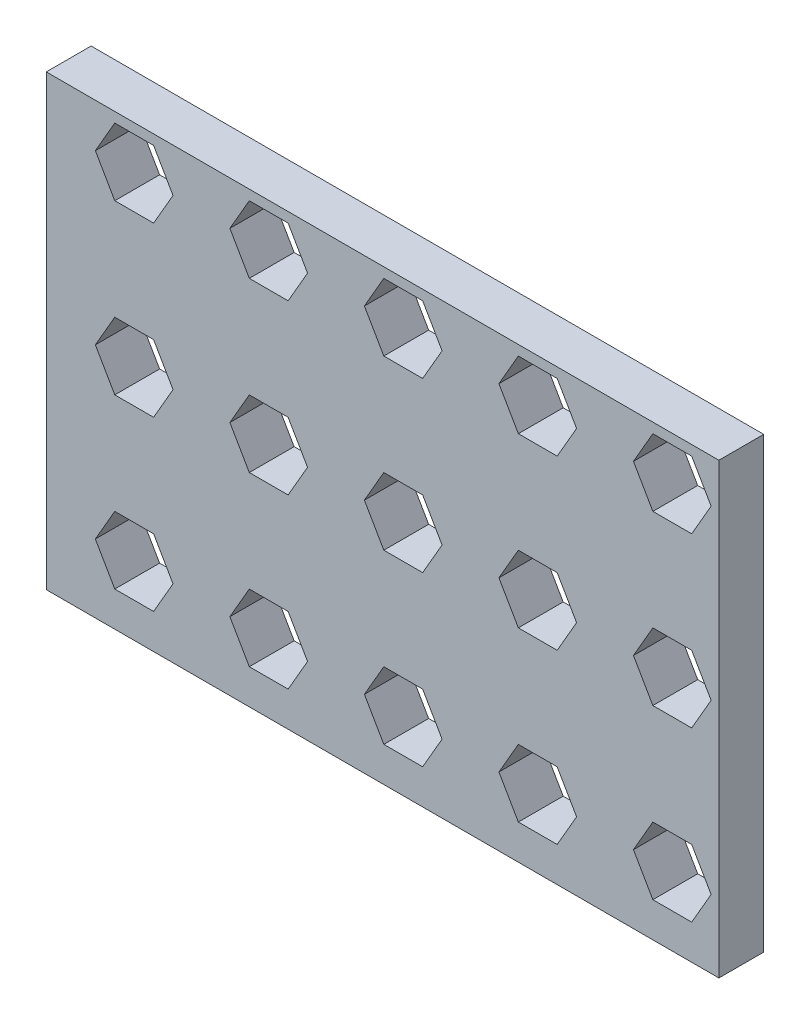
SolidWorks part; units mm, degrees
ref_plane "前视基准面" through (0, 0, 0) normal (0, 0, 1) x (1, 0, 0)
ref_plane "上视基准面" through (0, 0, 0) normal (0, 1, 0) x (1, 0, 0)
ref_plane "右视基准面" through (0, 0, 0) normal (1, 0, 0) x (0, 0, -1)
sketch "草图1" plane through (0, 0, 0) normal (0, 0, 1) x (1, 0, 0)
  line L1 (0, 40) -> (60, 40)
  line L2 (0, 40) -> (0, 0)
  line L3 (0, 0) -> (60, 0)
  line L4 (60, 40) -> (60, 0)
  dimension "D1" = 60
  dimension "D2" = 40
extrude "凸台-拉伸1" add sketch "草图1" along normal blind 4
sketch "草图2" plane through (0, 0, 4) normal (0, 0, 1) x (1, 0, 0)
  line L1 (11.3068, 6.1042) -> (9.5747, 9.1042)
  line L2 (9.5747, 9.1042) -> (6.1106, 9.1042)
  line L3 (6.1106, 9.1042) -> (4.3786, 6.1042)
  line L4 (4.3786, 6.1042) -> (6.1106, 3.1042)
  line L5 (6.1106, 3.1042) -> (9.5747, 3.1042)
  line L6 (9.5747, 3.1042) -> (11.3068, 6.1042)
  circle A0 centre (7.8427, 6.1042) radius 3 construction
extrude "切除-拉伸1" cut sketch "草图2" against normal through all
pattern_linear "阵列(线性)1" count 5 spacing 12 along (1, 0, 0) count 3 spacing 15 along (0, 1, 0) of "切除-拉伸1"
